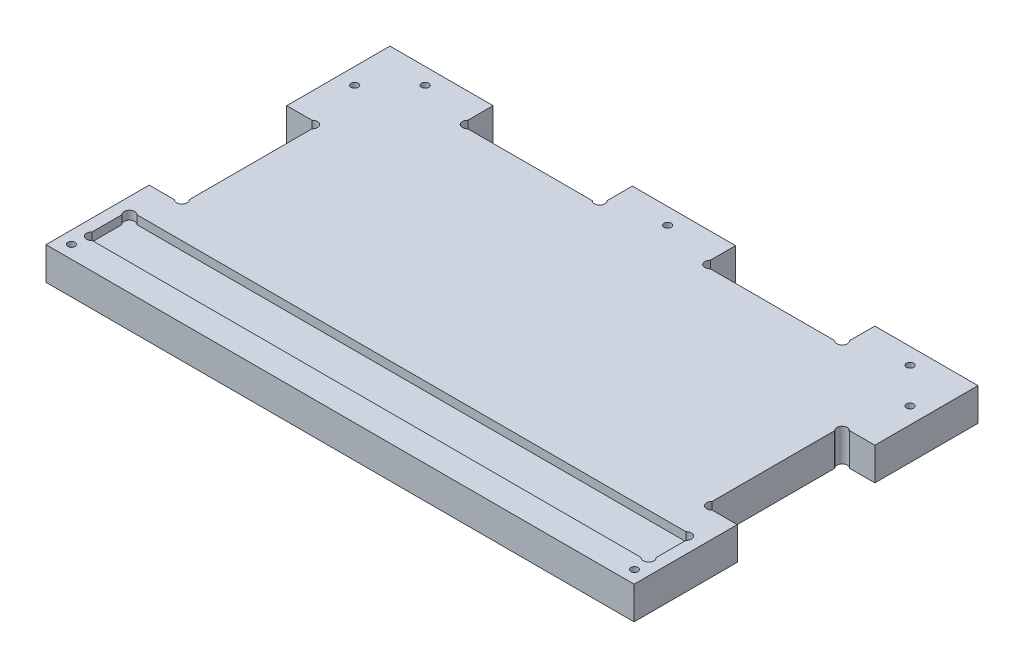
SolidWorks part; units mm, degrees
ref_plane "Plan de face" through (0, 0, 0) normal (0, 0, 1) x (1, 0, 0)
ref_plane "Plan de dessus" through (0, 0, 0) normal (0, 1, 0) x (1, 0, 0)
ref_plane "Plan de droite" through (0, 0, 0) normal (1, 0, 0) x (0, 0, -1)
sketch "Esquisse1" plane through (0, 0, 0) normal (0, 1, 0) x (1, 0, 0)
  line L0 (-25.5424, 15.5) -> (374.2995, 15.5) construction
  line L1 (0, 0) -> (342, 0)
  line L2 (0, 0) -> (0, 60)
  line L3 (0, 200) -> (60, 200)
  line L4 (342, 0) -> (342, 60)
  line L5 (-25.5424, 41.5) -> (371.2704, 41.5) construction
  line L6 (7, 58.5308) -> (7, 4.7655) construction
  line L7 (335, 58.5308) -> (335, 7.0373) construction
  line L8 (171, 209.5813) -> (171, -27.8994) construction
  line L9 (11.3804, 41.5) -> (330.6196, 41.5)
  line L10 (7, 37.1196) -> (7, 19.8804)
  line L11 (11.3804, 15.5) -> (330.6196, 15.5)
  line L12 (335, 37.1196) -> (335, 19.8804)
  line L13 (-66.5578, 140) -> (76.6525, 140) construction
  line L14 (-57.1302, 60) -> (70.8163, 60) construction
  line L15 (19, 209.5813) -> (19, -10.8403) construction
  line L16 (0, 140) -> (14.6881, 140)
  line L17 (19, 135.6881) -> (19, 64.3119)
  line L18 (14.6881, 60) -> (0, 60)
  line L19 (327.3119, 60) -> (342, 60)
  line L20 (323, 135.6881) -> (323, 64.3119)
  line L21 (342, 140) -> (327.3119, 140)
  line L22 (0, 140) -> (0, 200)
  line L23 (342, 140) -> (342, 200)
  line L24 (323, 65.6898) -> (323, -1.9234) construction
  line L25 (329, 65.6898) -> (329, -1.9234) construction
  line L26 (317.738, 51.5) -> (331.3355, 51.5) construction
  line L27 (319.6007, 5.5) -> (333.0119, 5.5) construction
  line L28 (334.75, 23.6662) -> (334.75, -93.5901) construction
  line L29 (60, 222.3781) -> (60, 166.9668) construction
  line L30 (141, 218.738) -> (141, 160.4954) construction
  line L31 (-6.3153, 181) -> (239.1994, 181) construction
  line L32 (60, 200) -> (60, 185.3119)
  line L33 (64.3119, 181) -> (136.6881, 181)
  line L34 (141, 185.3119) -> (141, 200)
  line L35 (141, 200) -> (201, 200)
  line L36 (201, 185.3119) -> (201, 200)
  line L37 (277.6881, 181) -> (205.3119, 181)
  line L38 (282, 200) -> (282, 185.3119)
  line L39 (282, 200) -> (342, 200)
  arc A0 (19, 135.6881) -> (14.6881, 140) centre (16.9, 137.9) ccw
  arc A1 (14.6881, 60) -> (19, 64.3119) centre (16.9, 62.1) ccw
  arc A2 (327.3119, 60) -> (323, 64.3119) centre (325.1, 62.1) cw
  arc A3 (323, 135.6881) -> (327.3119, 140) centre (325.1, 137.9) cw
  circle A4 centre (334.75, 7.5) radius 2.1
  circle A5 centre (7.25, 7.5) radius 2.1
  arc A6 (60, 185.3119) -> (64.3119, 181) centre (62.1, 183.1) ccw
  arc A7 (136.6881, 181) -> (141, 185.3119) centre (138.9, 183.1) ccw
  arc A8 (205.3119, 181) -> (201, 185.3119) centre (203.1, 183.1) cw
  arc A9 (282, 185.3119) -> (277.6881, 181) centre (279.9, 183.1) cw
  circle A10 centre (9.5, 170) radius 2.1
  circle A11 centre (30, 190.5) radius 2.1
  circle A12 centre (171, 190.5) radius 2.1
  circle A13 centre (312, 190.5) radius 2.1
  circle A14 centre (332.5, 170) radius 2.1
  arc A15 (11.3804, 41.5) -> (7, 37.1196) centre (9.1, 39.4) ccw
  arc A16 (7, 19.8804) -> (11.3804, 15.5) centre (9.1, 17.6) ccw
  arc A17 (335, 37.1196) -> (330.6196, 41.5) centre (332.9, 39.4) ccw
  arc A18 (330.6196, 15.5) -> (335, 19.8804) centre (332.9, 17.6) ccw
  dimension "D10" = 2.1
  dimension "D12" = 2.1
  dimension "D18" = 7.5
  dimension "D22" = 2.1
  dimension "D26" = 9.5
  dimension "D31" = 2.1
  dimension "D33" = 2.1
  dimension "D35" = 2.1
  dimension "D37" = 2.1
  dimension "D1" = 342
  dimension "D2" = 200
  dimension "D3" = 15.5
  dimension "D4" = 26
  dimension "D5" = 7
  dimension "D6" = 7
  dimension "D7" = 60
  dimension "D8" = 60
  dimension "D9" = 19
  dimension "D11" = 2.1
  dimension "D13" = 2.1
  dimension "D14" = 6
  dimension "D15" = 10
  dimension "D16" = 10
  dimension "D17" = 7.25
  dimension "D19" = 60
  dimension "D20" = 30
  dimension "D21" = 19
  dimension "D23" = 2.1
  dimension "D24" = 2.1
  dimension "D25" = 2.1
  dimension "D27" = 30
  dimension "D28" = 30
  dimension "D29" = 9.5
  dimension "D30" = 9.5
  dimension "D32" = 2.1
  dimension "D34" = 2.1
  dimension "D36" = 2.1
  dimension "D38" = 2.1
extrude "Boss.-Extru.1" add sketch "Esquisse1" against normal blind 19
sketch "Esquisse2" plane through (0, -19, 0) normal (0, -1, 0) x (1, 0, 0)
  line L1 (4.6847, -12.2151) -> (338.602, -12.2151)
  line L2 (4.6847, -12.2151) -> (4.6847, -45.8396)
  line L3 (4.6847, -45.8396) -> (338.602, -45.8396)
  line L4 (338.602, -12.2151) -> (338.602, -45.8396)
extrude "Boss.-Extru.2" add sketch "Esquisse2" against normal blind 14
